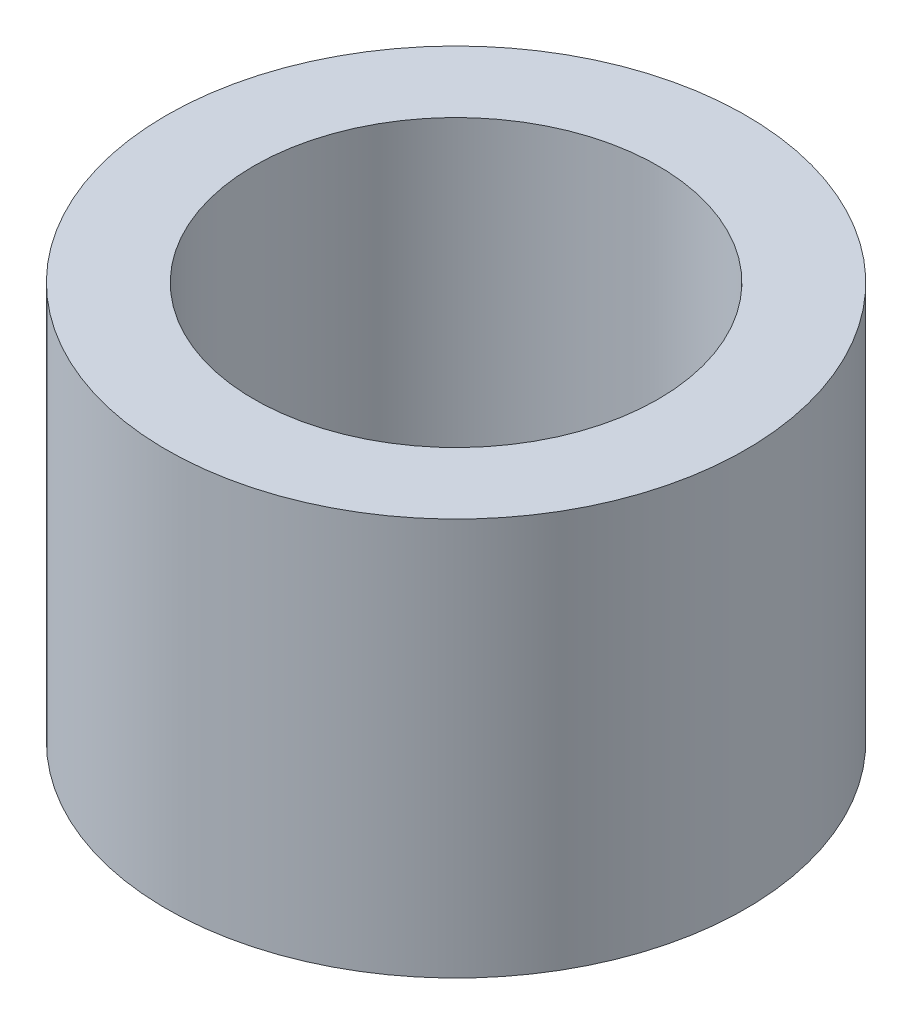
SolidWorks part; units mm, degrees
ref_plane "Front Plane" through (0, 0, 0) normal (0, 0, 1) x (1, 0, 0)
ref_plane "Top Plane" through (0, 0, 0) normal (0, 1, 0) x (1, 0, 0)
ref_plane "Right Plane" through (0, 0, 0) normal (1, 0, 0) x (0, 0, -1)
sketch "Sketch1" plane through (0, 0, 0) normal (0, 0, 1) x (1, 0, 0)
  line L0 (0, 25.2723) -> (0, -33.6422) construction
  line L1 (0, -1.65) -> (0, 1.65) construction
  line L3 (2.365, 0) -> (-2.365, 0) construction
  line L6 (1.5, 0) -> (1.5, 2.95)
  line L7 (1.5, 2.95) -> (2.15, 2.95)
  line L8 (2.15, 2.95) -> (2.15, 0)
  line L9 (2.15, 0) -> (1.5, 0)
  dimension "D1" = 3
  dimension "D2" = 4.3
  dimension "D3" = 2.95
revolve "Revolve1" add sketch "Sketch1" angle 360 about L0
